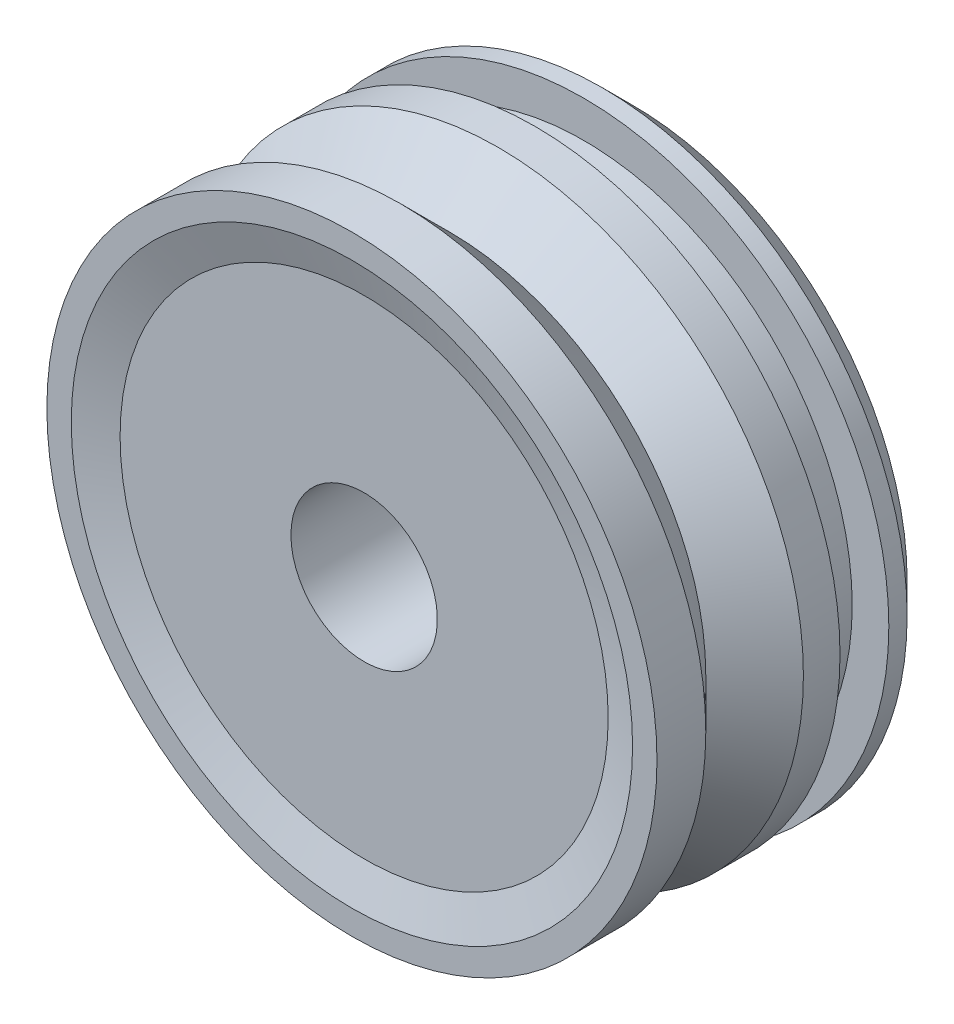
SolidWorks part; units mm, degrees
ref_plane "Face" through (0, 0, 0) normal (0, 0, 1) x (1, 0, 0)
ref_plane "Dessus" through (0, 0, 0) normal (0, 1, 0) x (1, 0, 0)
ref_plane "Droite" through (0, 0, 0) normal (1, 0, 0) x (0, 0, -1)
sketch "Esquisse1" plane through (0, 0, 0) normal (0, 0, 1) x (1, 0, 0)
  circle A0 centre (0, 0) radius 12.5
  dimension "D1" = 25
extrude "Extrusion1" add sketch "Esquisse1" along normal blind 11.5
sketch "Esquisse2" plane through (0, 0, 11.5) normal (0, 0, 1) x (1, 0, 0)
  circle A0 centre (0, 0) radius 11.5
  dimension "D1" = 23
ref_plane "Plan1" through (0, 0, 11) normal (0, 0, 1) x (1, 0, 0)
sketch "Esquisse3" plane through (0, 0, 11) normal (0, 0, 1) x (1, 0, 0)
  circle A0 centre (0, 0) radius 10
  dimension "D1" = 20
loft "Enlèvement de matière-Lissage1" cut profiles "Esquisse2", "Esquisse3"
chamfer "Chanfrein1" distance 1.25 angle 45
sketch "Esquisse4" plane through (0, 0, 0) normal (0, 1, 0) x (1, 0, 0)
  line L0 (0, 3.3987) -> (0, -15.3727) construction
  line L1 (-12.5, -1.25) -> (-12.5, -11.5) construction
  line L2 (-12.5, -2) -> (-11, -2)
  line L3 (-12.5, -2) -> (-12.5, -4)
  line L4 (-12.5, -4) -> (-11, -4)
  line L5 (-11, -2) -> (-11, -4)
  line L6 (-12.5, -5.5) -> (-12.5, -9.5)
  line L7 (-12.5, -9.5) -> (-10.5, -7.5)
  line L8 (-10.5, -7.5) -> (-12.5, -5.5)
  line L9 (11.25, 0) -> (-11.25, 0) construction
  dimension "D1" = 2
  dimension "D2" = 22
  dimension "D3" = 2
  dimension "D4" = 2
  dimension "D5" = 45
  dimension "D6" = 4
revolve "Enlèvement de matière-Révolution1" cut sketch "Esquisse4" angle 360 about L0
sketch "Esquisse5" plane through (0, 0, 0) normal (0, 0, -1) x (-1, 0, 0)
  circle A0 centre (0, 0) radius 9.5
  circle A1 centre (0, 0) radius 6
  dimension "D1" = 19
  dimension "D2" = 12
extrude "Enlèv. mat.-Extru.1" cut sketch "Esquisse5" against normal blind 6
chamfer "Chanfrein2" distance 0.5 angle 45
sketch "Esquisse6" plane through (0, 0, 0) normal (0, 0, -1) x (-1, 0, 0)
  circle A0 centre (0, 0) radius 3 construction
  circle A1 centre (0, 0) radius 3
extrude "Enlèv. mat.-Extru.2" cut sketch "Esquisse6" against normal through all
